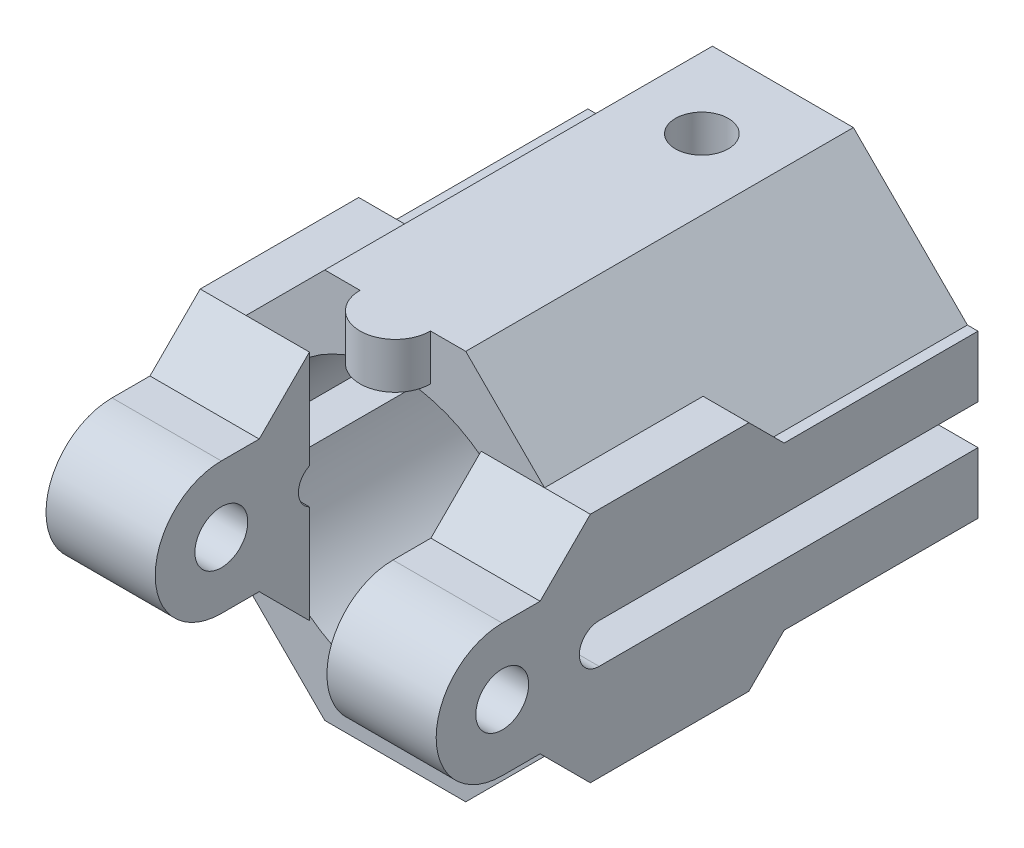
SolidWorks part; units mm, degrees
ref_plane "Front Plane" through (0, 0, 0) normal (0, 0, 1) x (1, 0, 0)
ref_plane "Top Plane" through (0, 0, 0) normal (0, 1, 0) x (1, 0, 0)
ref_plane "Right Plane" through (0, 0, 0) normal (1, 0, 0) x (0, 0, -1)
sketch "Sketch1" plane through (0, 0, 0) normal (0, 0, 1) x (1, 0, 0)
  line L0 (-11.0711, 4) -> (-11.0711, -4)
  line L1 (11.0711, 4) -> (11.0711, -4)
  line L2 (-4, -11.0711) -> (4, -11.0711)
  line L3 (-4, 11.0711) -> (4, 11.0711)
  line L4 (-1000, 0) -> (49000, 0) construction
  line L5 (0, -1000) -> (0, 49000) construction
  line L6 (-11.0711, -4) -> (-4, -11.0711)
  line L7 (-11.0711, 4) -> (-4, 11.0711)
  line L8 (4, 11.0711) -> (11.0711, 4)
  line L9 (11.0711, -4) -> (4, -11.0711)
  circle A0 centre (0, 0) radius 8
  dimension "D1" = 16
  dimension "D2" = 4
  dimension "D3" = 8
  dimension "D4" = 8
  dimension "D5" = 4
  dimension "D6" = 8
  dimension "D7" = 4
  dimension "D8" = 8
  dimension "D9" = 4
  dimension "D10" = 45
  dimension "D11" = 10
  dimension "D12" = 45
  dimension "D13" = 45
extrude "Boss-Extrude1" add sketch "Sketch1" along normal blind 22
sketch "Sketch2" plane through (11.0711, 0, 0) normal (1, 0, 0) x (0, 0, -1)
  line L0 (0, -4) -> (0, 4) construction
  line L1 (0, -4.6) -> (-11, -4.6)
  line L2 (0, -4.6) -> (0, 4.6)
  line L3 (0, 4.6) -> (-11, 4.6)
  line L4 (-11, -4.6) -> (-11, 4.6) construction
  line L5 (-11, -4.6) -> (-13.0058, -6.6)
  line L6 (-11, 6.6) -> (-30, 6.6) construction
  line L7 (-11, 6.6) -> (-11, -6.6) construction
  line L8 (-11, -6.6) -> (-30, -6.6) construction
  line L9 (-30, 6.6) -> (-30, -6.6) construction
  line L10 (-11, 4.6) -> (-13.0029, 6.6)
  line L11 (-22, 6.6) -> (-24.85, 3.75)
  line L12 (-13.0058, 4.6) -> (-22.0058, 4.6) construction
  line L13 (-11, 4.6) -> (-11, -4.6) construction
  line L14 (-13.0058, 4.6) -> (-13.0058, -4.6) construction
  line L15 (-13.0058, -4.6) -> (-22.0058, -4.6) construction
  line L16 (-22.0058, 4.6) -> (-22.0058, -4.6) construction
  line L17 (-22, 4) -> (-22, 11.0711) construction
  line L18 (-22, -6.6) -> (-24.85, -3.75)
  line L19 (-22, -11.0711) -> (-22, -4) construction
  line L20 (-1000, 0) -> (49000, 0) construction
  line L21 (-27, 3.75) -> (-22.0058, 3.75)
  line L22 (-27, -3.75) -> (-22.0058, -3.75)
  line L23 (-22, -6.6) -> (-13.0058, -6.6)
  line L24 (-22, 6.6) -> (-13.0029, 6.6)
  circle A0 centre (-27, 0) radius 3.75
  circle A1 centre (-27, 0) radius 1.5
  dimension "D17" = 3
  dimension "D18" = 7.5
  dimension "D1" = 11
  dimension "D2" = 9.2
  dimension "D3" = 4.6
  dimension "D4" = 19
  dimension "D5" = 0
  dimension "D6" = 13.2
  dimension "D7" = 6.6
  dimension "D8" = 9
  dimension "D9" = 0
  dimension "D10" = 4.6
  dimension "D11" = 9.2
  dimension "D12" = 0
  dimension "D13" = 45
  dimension "D14" = 45
  dimension "D15" = 0
  dimension "D16" = 0
  dimension "D19" = 27
extrude "Boss-Extrude3" add sketch "Sketch2" against normal blind 6.2
sketch "Sketch6" plane through (-11.0711, 0, 0) normal (-1, 0, 0) x (0, 0, 1)
  line L0 (11, -4.7491) -> (0, -4.7491)
  line L1 (0, -4.7491) -> (0, 4.4509)
  line L2 (11, 4.4509) -> (0, 4.4509)
  line L22 (0, 11.0711) -> (0, 4) construction
  line L23 (22.0058, 4.6) -> (22.0058, -4.6) construction
  line L24 (13.0058, -4.6) -> (22.0058, -4.6) construction
  line L25 (13.0058, 4.6) -> (13.0058, -4.6) construction
  line L26 (11, 4.4509) -> (11, -4.7491) construction
  line L27 (13.0058, 4.6) -> (22.0058, 4.6) construction
  line L28 (30, 6.6) -> (30, -6.6) construction
  line L29 (11, -6.6) -> (30, -6.6) construction
  line L30 (11, 6.6) -> (11, -6.6) construction
  line L31 (11, 6.6) -> (30, 6.6) construction
  line L32 (11, -4.7491) -> (11, 4.4509) construction
  line L33 (22, 6.6) -> (13.0029, 6.6)
  line L34 (22, -6.6) -> (13.0058, -6.6)
  line L35 (27, -3.75) -> (22.0058, -3.75)
  line L36 (27, 3.75) -> (22.0058, 3.75)
  line L37 (22, -6.6) -> (24.85, -3.75)
  line L38 (22, 6.6) -> (24.85, 3.75)
  line L39 (11, 4.4509) -> (13.0029, 6.6)
  line L40 (11, -4.7491) -> (13.0058, -6.6)
  circle A2 centre (27, 0) radius 1.5
  circle A3 centre (27, 0) radius 3.75
  point P4 (-11, -4.7491)
  dimension "D2" = 9.2
extrude "Boss-Extrude4" add sketch "Sketch6" against normal blind 6.2
sketch "Sketch7" plane through (11.0711, 0, 0) normal (1, 0, 0) x (0, 0, -1)
  line L0 (0, -4.6) -> (0, 4.6) construction
  line L1 (0, 1.125) -> (-21.5, 1.125)
  line L2 (0, 1.125) -> (0, -1.125)
  line L3 (0, -1.125) -> (-21.5, -1.125)
  line L4 (-21.5, 1.125) -> (-21.5, -1.125)
  circle A0 centre (-21.5, 0) radius 1.125
  dimension "D1" = 21.5
  dimension "D2" = 1.125
  dimension "D3" = 2.25
extrude "Cut-Extrude2" cut sketch "Sketch7" against normal blind 30 contours A0 L3 L1 M4 | L4 A0 | L4 A0
sketch "Sketch8" plane through (0, 11.0711, 0) normal (0, 1, 0) x (1, 0, 0)
  circle A0 centre (0, -4.6) radius 1.5
  dimension "D1" = 3
  dimension "D2" = 4.6
extrude "Cut-Extrude3" cut sketch "Sketch8" against normal blind 30
sketch "Sketch9" plane through (0, 0, 0) normal (0, 0, -1) x (-1, 0, 0)
  circle A0 centre (0, 0) radius 8
extrude "Cut-Extrude4" cut sketch "Sketch9" against normal blind 22
sketch "Sketch10" plane through (0, 11.0711, 0) normal (0, 1, 0) x (1, 0, 0)
  line L0 (0, -1000) -> (0, 49000) construction
  line L1 (4, -22) -> (-4, -22) construction
  circle A0 centre (0, -22) radius 2
  dimension "D1" = 4
extrude "Boss-Extrude5" add sketch "Sketch10" against normal blind 2.6
sketch "Sketch11" plane through (0, -11.0711, 0) normal (0, -1, 0) x (1, 0, 0)
  line L0 (-4, 22) -> (-4, 0) construction
  line L1 (-2.6, 18.4) -> (2.6, 18.4)
  line L2 (-2.6, 18.4) -> (-2.6, 11.9)
  line L3 (-2.6, 11.9) -> (2.6, 11.9)
  line L4 (2.6, 18.4) -> (2.6, 11.9)
  line L5 (4, 22) -> (4, 0) construction
  line L6 (-4, 22) -> (4, 22) construction
  circle A0 centre (0, 18.4) radius 2.6
  circle A1 centre (0, 11.9) radius 2.6
  dimension "D1" = 1.4
  dimension "D2" = 6.5
  dimension "D3" = 1.4
  dimension "D4" = 3.6
extrude "Cut-Extrude5" cut sketch "Sketch11" against normal blind 1 contours L1 A0 | A1 L4 A0 L2 | L3 A1 | L3 A1 | L1 A0
